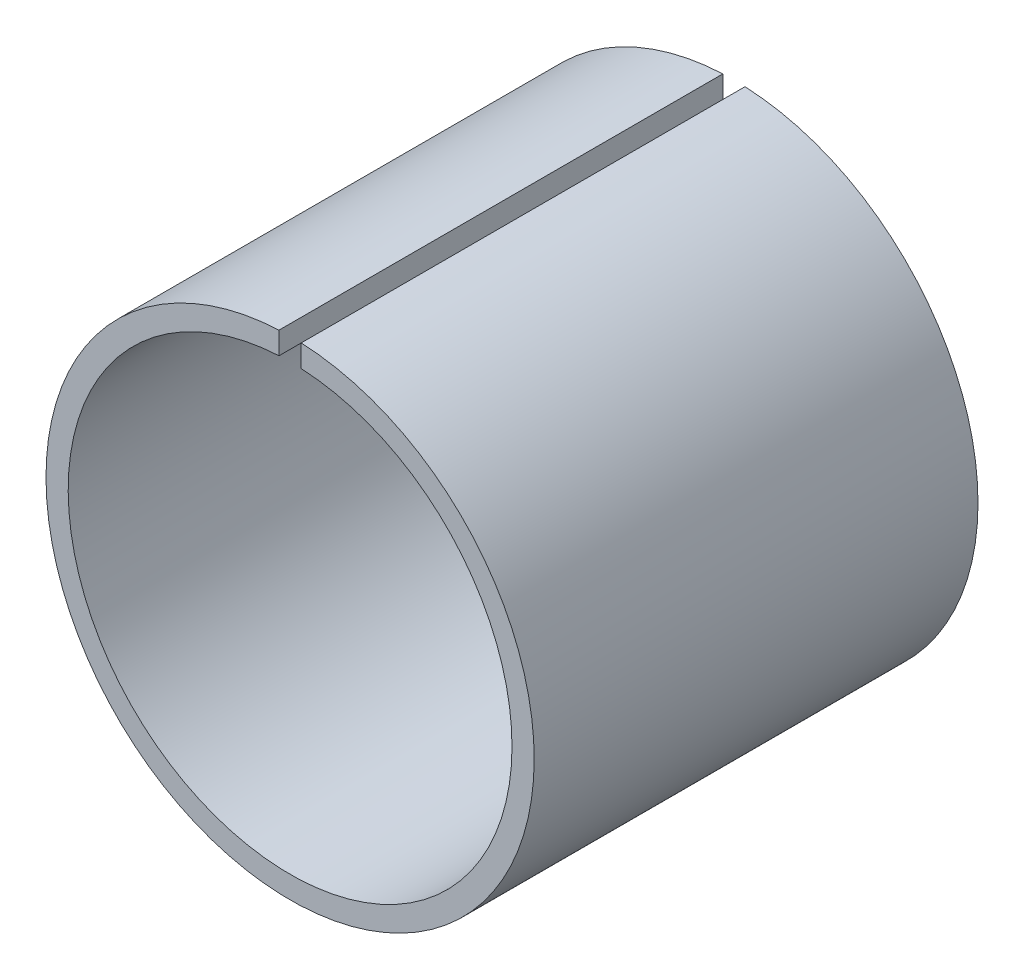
SolidWorks part; units mm, degrees
ref_plane "Ebene vorne" through (0, 0, 0) normal (0, 0, 1) x (1, 0, 0)
ref_plane "Ebene oben" through (0, 0, 0) normal (0, 1, 0) x (1, 0, 0)
ref_plane "Ebene rechts" through (0, 0, 0) normal (1, 0, 0) x (0, 0, -1)
sketch "Skizze1" plane through (0, 0, 0) normal (0, 0, 1) x (1, 0, 0)
  circle A0 centre (0, 0) radius 50
  circle A1 centre (0, 0) radius 55
  dimension "D1" = 100
  dimension "D2" = 5
extrude "Aufsatz-Linear austragen1" add sketch "Skizze1" against normal blind 100
sketch "Skizze2" plane through (0, 0, 0) normal (0, 0, 1) x (1, 0, 0)
  line L0 (0, 0) -> (0, 62.13) construction
  line L1 (2.5, 49.9375) -> (2.5, 54.9432)
  line L2 (-2.5, 49.9375) -> (-2.5, 54.9432)
  line L4 (-2.5, 0) -> (-2.5, 62.13) construction
  line L5 (2.5, 0) -> (2.5, 62.13) construction
  circle A0 centre (0, 0) radius 50 construction
  circle A1 centre (0, 0) radius 55 construction
  arc A2 (2.5, 49.9375) -> (-2.5, 49.9375) centre (0, 0) ccw
  arc A3 (2.5, 54.9432) -> (-2.5, 54.9432) centre (0, 0) ccw
  dimension "D1" = 2.5
  dimension "D2" = 2.5
extrude "Schnitt-Linear austragen1" cut sketch "Skizze2" against normal blind 100
